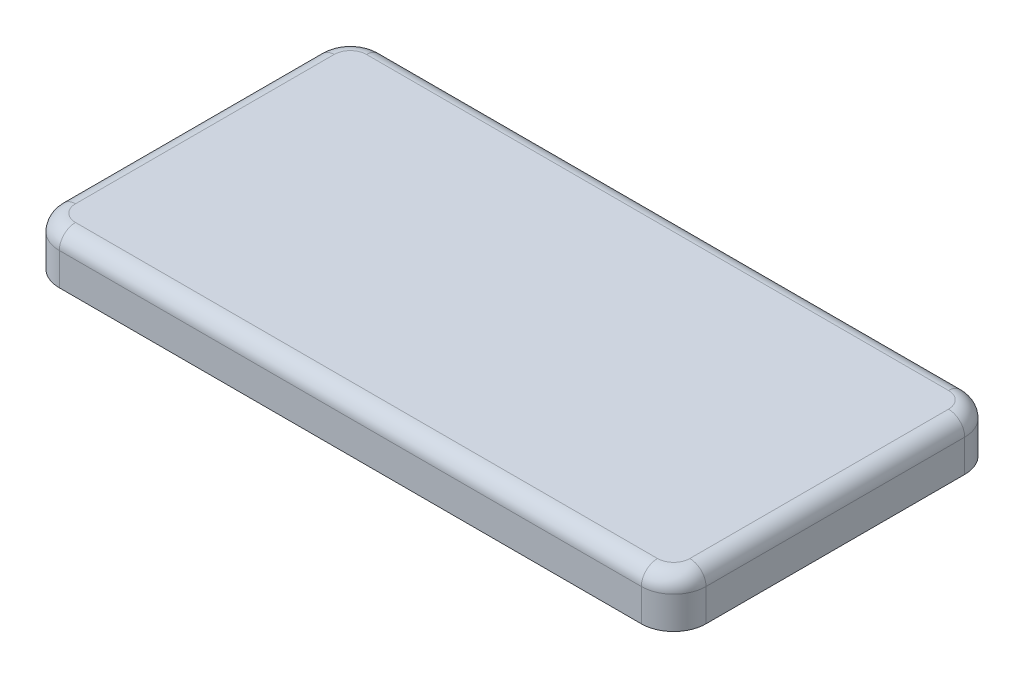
SolidWorks part; units mm, degrees
ref_plane "正面" through (0, 0, 0) normal (0, 0, 1) x (1, 0, 0)
ref_plane "平面" through (0, 0, 0) normal (0, 1, 0) x (1, 0, 0)
ref_plane "右側面" through (0, 0, 0) normal (1, 0, 0) x (0, 0, -1)
sketch "ｽｹｯﾁ1" plane through (0, 0, 0) normal (0, 1, 0) x (0, 0, -1)
  line L1 (-8, 20) -> (8, 20)
  line L2 (-10, 18) -> (-10, -18)
  line L3 (-8, -20) -> (8, -20)
  line L4 (10, 18) -> (10, -18)
  arc A0 (10, 18) -> (8, 20) centre (8, 18) ccw
  arc A1 (8, -20) -> (10, -18) centre (8, -18) ccw
  arc A2 (-10, -18) -> (-8, -20) centre (-8, -18) ccw
  arc A3 (-8, 20) -> (-10, 18) centre (-8, 18) ccw
  point P7 (10, 20)
  point P10 (10, -20)
  point P15 (-10, 20)
  dimension "D5" = 2
  dimension "D1" = 10
  dimension "D2" = 20
  dimension "D3" = 20
  dimension "D4" = 40
extrude "押し出し1" add sketch "ｽｹｯﾁ1" along normal mid plane 3
fillet "ﾌｨﾚｯﾄ1" radius 1 8 edges at (-19.4142, 1.5, 9.4142) (-20, 1.5, 0) (-19.4142, 1.5, -9.4142) (0, 1.5, -10) (19.4142, 1.5, -9.4142) (20, 1.5, 0) (19.4142, 1.5, 9.4142) (0, 1.5, 10)
sketch "ｽｹｯﾁ2" plane through (0, -1.5, 0) normal (0, -1, 0) x (1, 0, 0)
  line L1 (-18, 8.8) -> (18, 8.8)
  line L2 (-18.8, 8) -> (-18.8, -8)
  line L3 (-18, -8.8) -> (18, -8.8)
  line L4 (18.8, 8) -> (18.8, -8)
  arc A0 (-18, 8.8) -> (-18.8, 8) centre (-18, 8) ccw
  arc A1 (18.8, 8) -> (18, 8.8) centre (18, 8) ccw
  arc A2 (18, -8.8) -> (18.8, -8) centre (18, -8) ccw
  arc A3 (-18.8, -8) -> (-18, -8.8) centre (-18, -8) ccw
  point P7 (-18.8, 8.8)
  point P10 (18.8, 8.8)
  point P13 (18.8, -8.8)
  dimension "D5" = 0.8
  dimension "D1" = 18.8
  dimension "D2" = 37.6
  dimension "D3" = 8.8
  dimension "D4" = 17.6
extrude "押し出し2" cut sketch "ｽｹｯﾁ2" against normal blind 1
sketch "ｽｹｯﾁ4" plane through (0, -0.5, 0) normal (0, -1, 0) x (1, 0, 0)
  line L0 (-20, -8) -> (-20, 8) construction
  line L1 (-12.15, 1.3) -> (-7.85, 1.3)
  line L2 (-12.15, 1.3) -> (-12.15, -1.3)
  line L3 (-12.15, -1.3) -> (-7.85, -1.3)
  line L4 (-7.85, 1.3) -> (-7.85, -1.3)
  line L6 (7.85, 1.3) -> (12.15, 1.3)
  line L7 (7.85, 1.3) -> (7.85, -1.3)
  line L8 (7.85, -1.3) -> (12.15, -1.3)
  line L9 (12.15, 1.3) -> (12.15, -1.3)
  dimension "D1" = 4.3
  dimension "D2" = 2.6
  dimension "D3" = 7.85
  dimension "D4" = 1.3
  dimension "D5" = 4.3
  dimension "D6" = 15.7
extrude "押し出し4" add sketch "ｽｹｯﾁ4" along normal blind 7 draft 0.5
fillet "ﾌｨﾚｯﾄ2" radius 1 8 edges at (-10, -7.5, 1.2389) (-7.9111, -7.5, 0) (-10, -7.5, -1.2389) (-12.0889, -7.5, 0) (10, -7.5, 1.2389) (12.0889, -7.5, 0) (10, -7.5, -1.2389) (7.9111, -7.5, 0)
